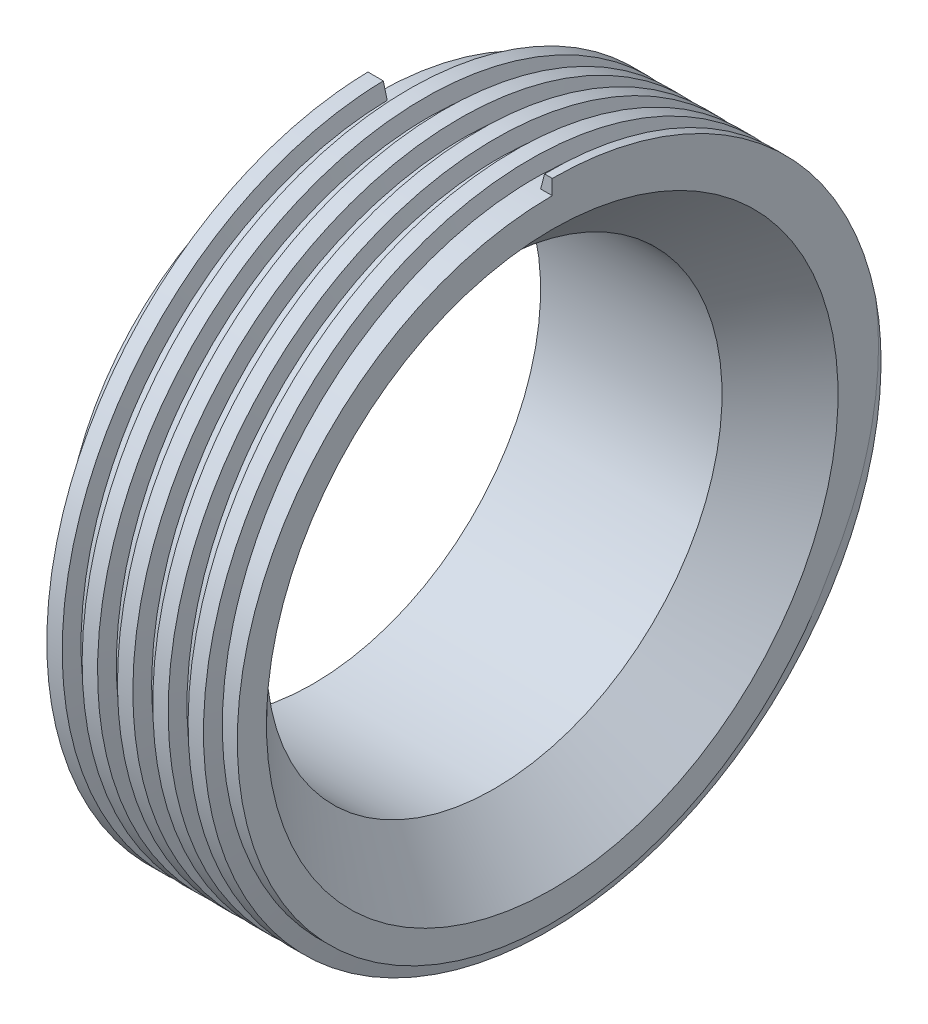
SolidWorks part; units mm, degrees
ref_plane "Front Plane" through (0, 0, 0) normal (0, 0, 1) x (1, 0, 0)
ref_plane "Top Plane" through (0, 0, 0) normal (0, 1, 0) x (1, 0, 0)
ref_plane "Right Plane" through (0, 0, 0) normal (1, 0, 0) x (0, 0, -1)
sketch "Sketch1" plane through (0, 0, 0) normal (0, 0, 1) x (1, 0, 0)
  line L0 (0, 0) -> (0, 19.05)
  line L1 (0, 19.05) -> (1.6256, 19.05)
  line L2 (4.8006, 22.225) -> (4.8006, 25.1968)
  line L3 (4.8006, 25.1968) -> (18.288, 25.1968)
  line L4 (18.288, 25.1968) -> (18.288, 0)
  line L5 (18.288, 0) -> (0, 0)
  arc A0 (4.8006, 22.225) -> (1.6256, 19.05) centre (1.6256, 22.225) cw
  dimension ".125" = 3.175
  dimension "D1" = 19.05
  dimension "D2" = 13.4874
  dimension "D3" = 18.288
  dimension "D4" = 25.1968
revolve "Revolve1" add sketch "Sketch1" angle 360 about L5
sketch "Sketch3" plane through (18.288, 0, 0) normal (1, 0, 0) x (0, 0, -1)
  circle A1 centre (0, 0) radius 25.1968
  circle A2 centre (0, 0) radius 25.1968
  dimension "D1" = 0
curve "Helix/Spiral1"
sketch "Sketch10" plane through (18.288, 0, 0) normal (1, 0, 0) x (0, 0, -1)
  circle A2 centre (0, 0) radius 24.0538
  circle A3 centre (0, 0) radius 24.0538
  dimension "D1" = 1.143
extrude "Cut-Extrude14" cut sketch "Sketch10" against normal blind 13.4874 flip side to cut
sketch "Sketch13" plane through (0, 0, 0) normal (0, 1, 0) x (1, 0, 0)
  line L0 (14.3281, 25.1966) -> (15.5042, 25.1966)
  line L1 (15.5042, 25.1966) -> (15.9804, 23.3551)
  line L2 (15.9804, 23.3551) -> (13.8519, 23.3551)
  line L3 (13.8519, 23.3551) -> (14.3281, 25.1966)
  line L4 (14.9162, 25.1966) -> (14.9162, 21.2583) construction
  dimension "D1" = 1.8415
  dimension "D2" = 1.176
  dimension "D3" = 14.5
  dimension "D4" = 14.5
sweep "Sweep1" add profiles "Sketch13" path "Helix/Spiral1"
sketch "Sketch15" plane through (0, 0, 0) normal (0, 0, 1) x (1, 0, 0)
  line L1 (18.288, -24.0538) -> (27.9826, -24.0538)
  line L2 (18.288, -24.0538) -> (18.288, 27.6213)
  line L3 (18.288, 27.6213) -> (27.9826, 27.6213)
  line L4 (27.9826, -24.0538) -> (27.9826, 27.6213)
extrude "Cut-Extrude15" cut sketch "Sketch15" against normal blind 25.4
sketch "Sketch16" plane through (0, 0, 0) normal (-1, 0, 0) x (0, 0, 1)
  circle A0 centre (0, 0) radius 17.399
extrude "Cut-Extrude16" cut sketch "Sketch16" against normal through all
chamfer "Chamfer1" distance 4.4298 angle 45 1 edges at (18.288, 17.399, 0)
